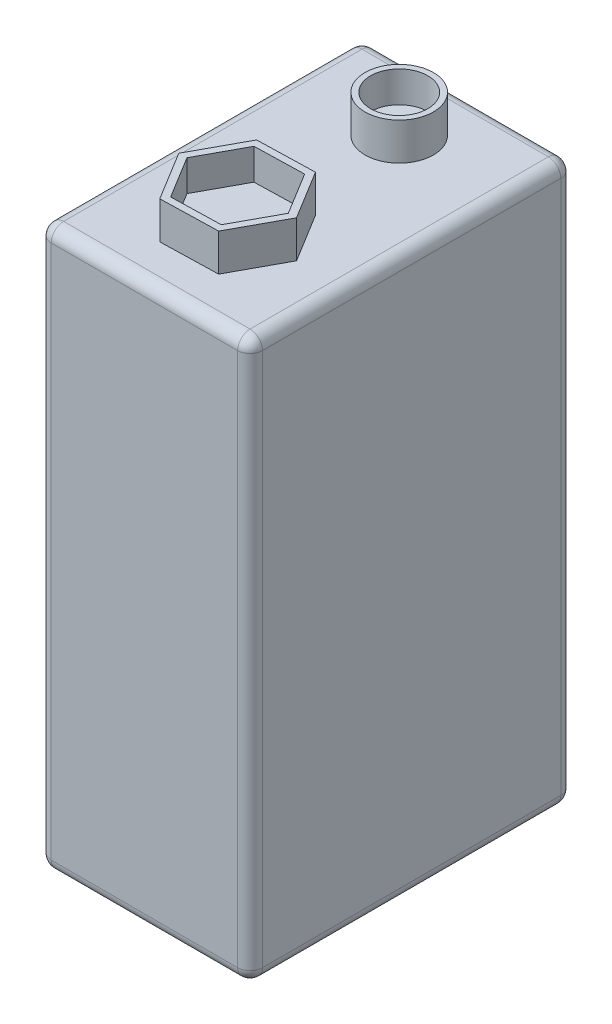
SolidWorks part; units mm, degrees
ref_plane "Plan1" through (0, 0, 0) normal (0, 0, 1) x (1, 0, 0)
ref_plane "Plan2" through (0, 0, 0) normal (0, 1, 0) x (1, 0, 0)
ref_plane "Plan3" through (0, 0, 0) normal (1, 0, 0) x (0, 0, -1)
sketch "Esquisse1" plane through (0, 0, 0) normal (0, 1, 0) x (1, 0, 0)
  line L1 (0, 0) -> (17, 0)
  line L2 (0, 0) -> (0, -26)
  line L3 (0, -26) -> (17, -26)
  line L4 (17, 0) -> (17, -26)
  dimension "D1" = 26
  dimension "D2" = 17
extrude "Base-Extrusion" add sketch "Esquisse1" along normal blind 45
fillet "Congé1" radius 1
fillet "Congé2" radius 1
fillet "Congé3" radius 1
fillet "Congé4" radius 1
sketch "Esquisse2" plane through (0, 45, 0) normal (0, 1, 0) x (-1, 0, 0)
  line L0 (-17, 1) -> (-17, 25) construction
  line L1 (-16, 25) -> (-16, 1) construction
  line L2 (-16, 1) -> (-1, 1) construction
  line L3 (-10.9132, 22.4382) -> (-13.1172, 18.3792)
  line L4 (-13.1172, 18.3792) -> (-10.704, 14.441)
  line L5 (-10.704, 14.441) -> (-6.0868, 14.5618)
  line L6 (-6.0868, 14.5618) -> (-3.8828, 18.6208)
  line L7 (-3.8828, 18.6208) -> (-6.296, 22.559)
  line L8 (-6.296, 22.559) -> (-10.9132, 22.4382)
  circle A0 centre (-8.5, 5.5) radius 2.75
  circle A1 centre (-8.5, 18.5) radius 4 construction
  dimension "D1" = 5.5
  dimension "D2" = 7.5
  dimension "D3" = 8
  dimension "D4" = 13
  dimension "D5" = 4.5
extrude "Boss.-Extru.2" add sketch "Esquisse2" along normal blind 3
sketch "Esquisse3" plane through (0, 48, 0) normal (0, 1, 0) x (-1, 0, 0)
  line L3 (-10.5766, 21.8888) -> (-12.4731, 18.396)
  line L4 (-12.4731, 18.396) -> (-10.3965, 15.0073)
  line L5 (-10.3965, 15.0073) -> (-6.4234, 15.1112)
  line L6 (-6.4234, 15.1112) -> (-4.5269, 18.604)
  line L7 (-4.5269, 18.604) -> (-6.6035, 21.9927)
  line L8 (-6.6035, 21.9927) -> (-10.5766, 21.8888)
  circle A0 centre (-8.5, 18.5) radius 3.4419 construction
extrude "Enlèv. mat.-Extru.1" cut sketch "Esquisse3" against normal blind 2.5
sketch "Esquisse4" plane through (0, 48, 0) normal (0, 1, 0) x (-1, 0, 0)
  circle A0 centre (-8.5, 5.5) radius 2.3
extrude "Enlèv. mat.-Extru.2" cut sketch "Esquisse4" against normal blind 2.5
